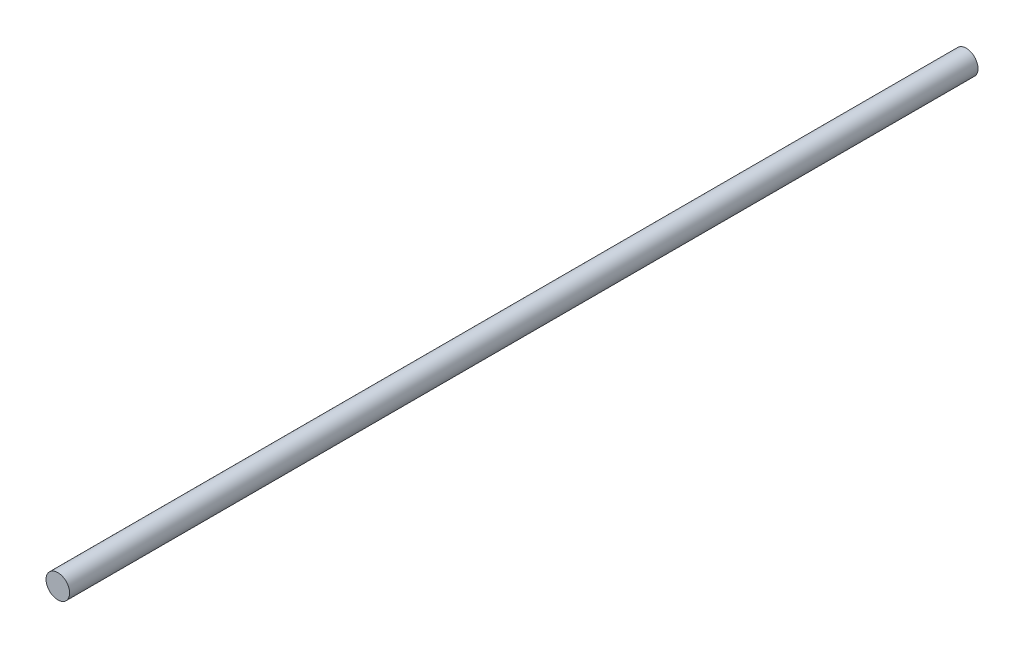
SolidWorks part; units mm, degrees
ref_plane "Спереди" through (0, 0, 0) normal (0, 0, 1) x (1, 0, 0)
ref_plane "Сверху" through (0, 0, 0) normal (0, 1, 0) x (1, 0, 0)
ref_plane "Справа" through (0, 0, 0) normal (1, 0, 0) x (0, 0, -1)
sketch "Эскиз1" plane through (0, 0, 0) normal (0, 0, 1) x (1, 0, 0)
  circle A0 centre (0, 0) radius 3.175
  dimension "D1" = 6.35
extrude "Бобышка-Вытянуть1" add sketch "Эскиз1" along normal blind 244
